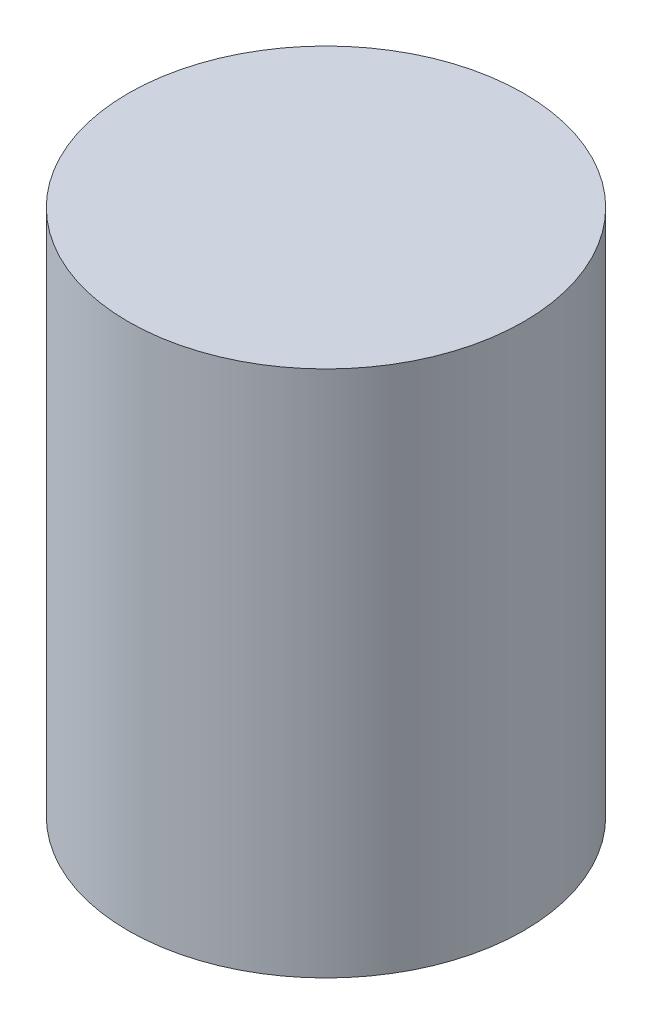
SolidWorks part; units mm, degrees
ref_plane "Front Plane" through (0, 0, 0) normal (0, 0, 1) x (1, 0, 0)
ref_plane "Top Plane" through (0, 0, 0) normal (0, 1, 0) x (1, 0, 0)
ref_plane "Right Plane" through (0, 0, 0) normal (1, 0, 0) x (0, 0, -1)
sketch "Sketch1" plane through (0, 0, 0) normal (0, 1, 0) x (1, 0, 0)
  circle A0 centre (0, 0) radius 38.1
  dimension "D1" = 76.2
extrude "Extrude1" add sketch "Sketch1" along normal blind 101.6
